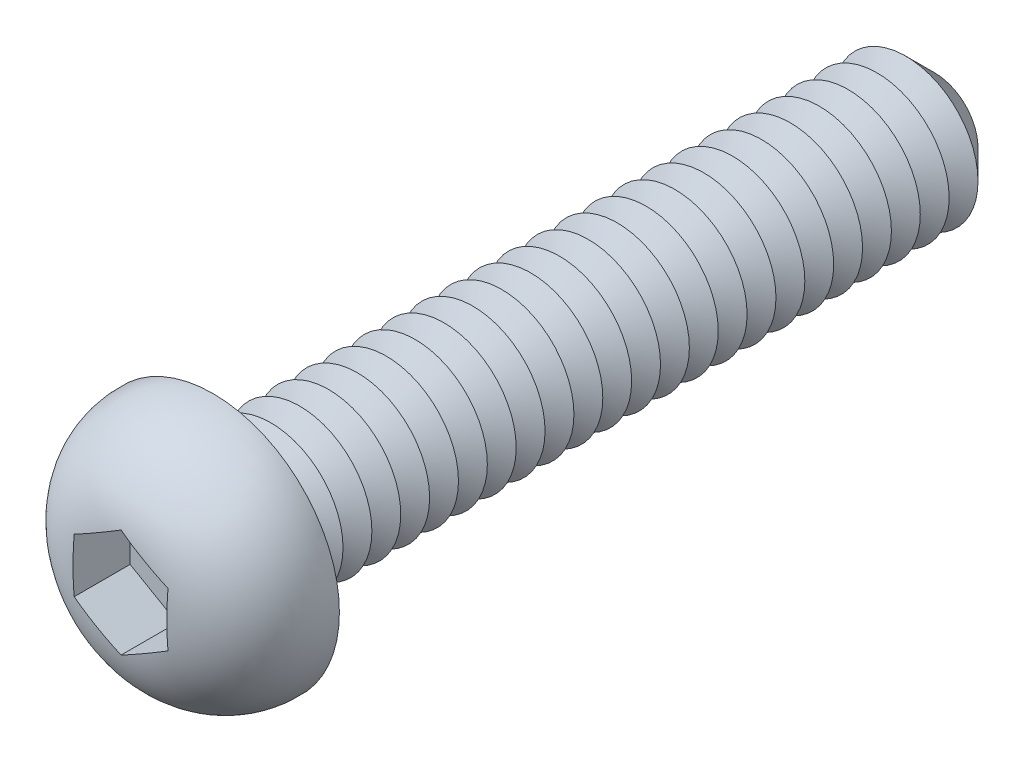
SolidWorks part; units mm, degrees
ref_plane "Front Plane" through (0, 0, 0) normal (0, 0, 1) x (1, 0, 0)
ref_plane "Top Plane" through (0, 0, 0) normal (0, 1, 0) x (1, 0, 0)
ref_plane "Right Plane" through (0, 0, 0) normal (1, 0, 0) x (0, 0, -1)
sketch "Sketch1" plane through (0, 0, 0) normal (1, 0, 0) x (0, 0, -1)
  line L0 (-47.9342, 0) -> (60.3146, 0) construction
sketch "Sketch2" plane through (0, 0, 0) normal (1, 0, 0) x (0, 0, -1)
  line L0 (0, 0) -> (-1.3, 0)
  line L1 (-47.9342, 0) -> (60.3146, 0) construction
  line L2 (-1.3, 0) -> (-1.3, 0.501)
  line L3 (0, 1.75) -> (0, 0)
  arc A0 (-1.3, 0.501) -> (0, 1.75) centre (-0.05, 0.501) cw
  dimension "D1" = 1.25
  dimension "D2" = 1.3
  dimension "D3" = 1.75
revolve "Revolve1" add sketch "Sketch2" angle 360 about L0
sketch "Sketch3" plane through (0, 0, 1.3) normal (0, 0, 1) x (1, 0, 0)
  line L1 (0, 0.7506) -> (-0.65, 0.3753)
  line L2 (-0.65, 0.3753) -> (-0.65, -0.3753)
  line L3 (-0.65, -0.3753) -> (0, -0.7506)
  line L4 (0, -0.7506) -> (0.65, -0.3753)
  line L5 (0.65, -0.3753) -> (0.65, 0.3753)
  line L6 (0.65, 0.3753) -> (0, 0.7506)
  circle A0 centre (0, 0) radius 0.65 construction
  dimension "D1" = 1.3
extrude "Cut-Extrude1" cut sketch "Sketch3" against normal blind 0.8
sketch "Sketch4" plane through (0, 0, 0) normal (0, 0, -1) x (-1, 0, 0)
  circle A0 centre (0, 0) radius 1
  dimension "D1" = 2
extrude "Boss-Extrude1" add sketch "Sketch4" along normal blind 10
chamfer "Chamfer1" distance 0.4 angle 45 1 edges at (-1, 0, -10)
sketch "Sketch5" plane through (0, 0, 0) normal (1, 0, 0) x (0, 0, -1)
  line L0 (0.4, 1) -> (0.8, 1)
  line L1 (9.6, 1) -> (0, 1) construction
  line L2 (0.8, 1) -> (0.6, 0.6536)
  line L3 (0.6, 0.6536) -> (0.4, 1)
  line L4 (0, -1.75) -> (0, 1.75) construction
  line L5 (9.6, 1) -> (0, 1) construction
  dimension "D1" = 0.4
  dimension "D2" = 0.4
revolve "Cut-Revolve1" cut sketch "Sketch5" angle 360 about L0
pattern_linear "LPattern1" count 23 spacing 0.4 along (0, 0, -1) of "Cut-Revolve1"
fillet "Fillet2" radius 0.2 1 edges at (-1, 0, 0)
sketch "Sketch6" plane through (0, 0, 0.5) normal (0, 0, 1) x (1, 0, 0)
  circle A0 centre (0, 0) radius 0.35
  dimension "D1" = 0.7
extrude "Cut-Extrude2" cut sketch "Sketch6" against normal up to surface (10.5 mm away)
